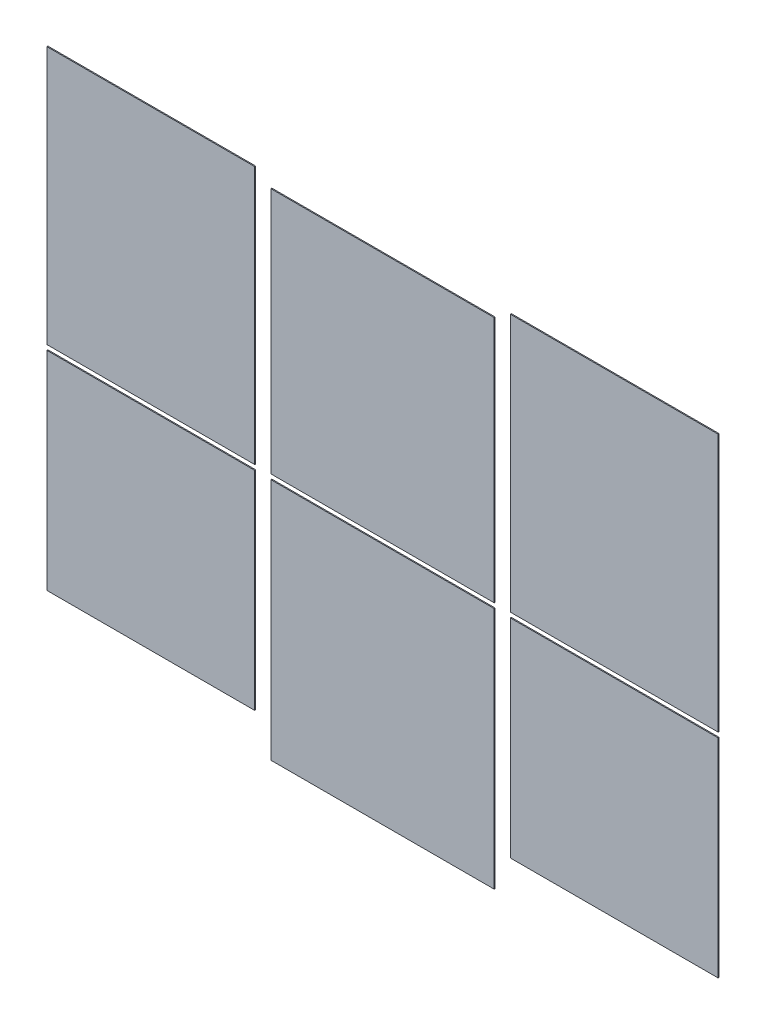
SolidWorks part; units mm, degrees
ref_plane "Top (Z)" through (0, 0, 0) normal (0, 0, 1) x (1, 0, 0)
ref_plane "Side (Y)" through (0, 0, 0) normal (0, 1, 0) x (1, 0, 0)
ref_plane "Front (X)" through (0, 0, 0) normal (1, 0, 0) x (0, 0, -1)
sketch "Sketch1" plane through (0, 0, 4.1) normal (0, 0, -1) x (-1, 0, 0)
  line L0 (-1332.4966, 1040.4351) -> (-502.4966, 1040.4351)
  line L1 (-1322.4966, 1030.4351) -> (-512.4966, 1030.4351) construction
  line L2 (-1322.4966, 1030.4351) -> (-1322.4966, 20.4351) construction
  line L3 (-1322.4966, 20.4351) -> (-512.4966, 20.4351) construction
  line L4 (-512.4966, 1030.4351) -> (-512.4966, 20.4351) construction
  line L5 (-1322.4966, -19.5649) -> (-512.4966, -19.5649) construction
  line L6 (-1322.4966, -19.5649) -> (-1322.4966, -829.5649) construction
  line L7 (-1322.4966, -829.5649) -> (-512.4966, -829.5649) construction
  line L8 (-512.4966, -19.5649) -> (-512.4966, -829.5649) construction
  line L9 (-428.4966, -969.5649) -> (443.5034, -969.5649) construction
  line L10 (-428.4966, -969.5649) -> (-428.4966, -19.5649) construction
  line L11 (-428.4966, -19.5649) -> (443.5034, -19.5649) construction
  line L12 (443.5034, -969.5649) -> (443.5034, -19.5649) construction
  line L13 (443.5034, 20.4351) -> (-428.4966, 20.4351) construction
  line L14 (443.5034, 20.4351) -> (443.5034, 986.4351) construction
  line L15 (443.5034, 986.4351) -> (-428.4966, 986.4351) construction
  line L16 (-428.4966, 20.4351) -> (-428.4966, 986.4351) construction
  line L17 (527.5034, -829.5649) -> (1337.5034, -829.5649) construction
  line L18 (527.5034, -829.5649) -> (527.5034, -19.5649) construction
  line L19 (527.5034, -19.5649) -> (1337.5034, -19.5649) construction
  line L20 (1337.5034, -829.5649) -> (1337.5034, -19.5649) construction
  line L21 (1337.5034, 20.4351) -> (527.5034, 20.4351) construction
  line L22 (1337.5034, 20.4351) -> (1337.5034, 1030.4351) construction
  line L23 (1337.5034, 1030.4351) -> (527.5034, 1030.4351) construction
  line L24 (527.5034, 20.4351) -> (527.5034, 1030.4351) construction
  line L25 (-502.4966, 1040.4351) -> (-502.4966, 10.4351)
  line L26 (-1332.4966, 10.4351) -> (-502.4966, 10.4351)
  line L27 (-1332.4966, 1040.4351) -> (-1332.4966, 10.4351)
  line L28 (-1332.4966, -9.5649) -> (-502.4966, -9.5649)
  line L29 (-502.4966, -9.5649) -> (-502.4966, -839.5649)
  line L30 (-1332.4966, -839.5649) -> (-502.4966, -839.5649)
  line L31 (-1332.4966, -9.5649) -> (-1332.4966, -839.5649)
  line L32 (-438.4966, -979.5649) -> (453.5034, -979.5649)
  line L33 (453.5034, -979.5649) -> (453.5034, -9.5649)
  line L34 (-438.4966, -9.5649) -> (453.5034, -9.5649)
  line L35 (-438.4966, -979.5649) -> (-438.4966, -9.5649)
  line L36 (453.5034, 10.4351) -> (-438.4966, 10.4351)
  line L37 (-438.4966, 10.4351) -> (-438.4966, 996.4351)
  line L38 (453.5034, 996.4351) -> (-438.4966, 996.4351)
  line L39 (453.5034, 10.4351) -> (453.5034, 996.4351)
  line L40 (517.5034, -839.5649) -> (1347.5034, -839.5649)
  line L41 (1347.5034, -839.5649) -> (1347.5034, -9.5649)
  line L42 (517.5034, -9.5649) -> (1347.5034, -9.5649)
  line L43 (517.5034, -839.5649) -> (517.5034, -9.5649)
  line L44 (1347.5034, 10.4351) -> (517.5034, 10.4351)
  line L45 (517.5034, 10.4351) -> (517.5034, 1040.4351)
  line L46 (1347.5034, 1040.4351) -> (517.5034, 1040.4351)
  line L47 (1347.5034, 10.4351) -> (1347.5034, 1040.4351)
  dimension "D1" = 10
extrude "Boss-Extrude1" add sketch "Sketch1" along normal blind 4
